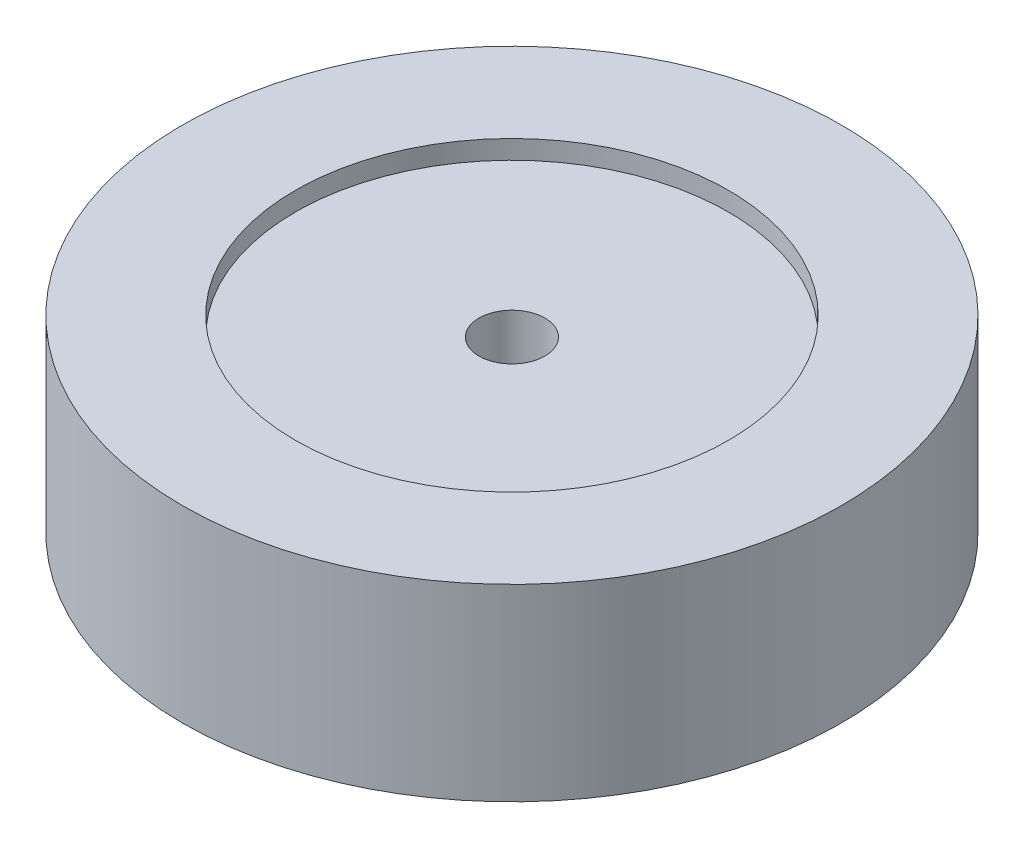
SolidWorks part; units mm, degrees
ref_plane "Front Plane" through (0, 0, 0) normal (0, 0, 1) x (1, 0, 0)
ref_plane "Top Plane" through (0, 0, 0) normal (0, 1, 0) x (1, 0, 0)
ref_plane "Right Plane" through (0, 0, 0) normal (1, 0, 0) x (0, 0, -1)
sketch "Sketch1" plane through (0, 0, 0) normal (0, 1, 0) x (1, 0, 0)
  circle A0 centre (0, 0) radius 17.5
  circle A1 centre (0, 0) radius 1.75
extrude "Extrude1" add sketch "Sketch1" along normal blind 10
sketch "Sketch2" plane through (0, 10, 0) normal (0, 1, 0) x (-1, 0, 0)
  circle A0 centre (0, 0) radius 11.5
extrude "Cut-Extrude1" cut sketch "Sketch2" against normal blind 1
